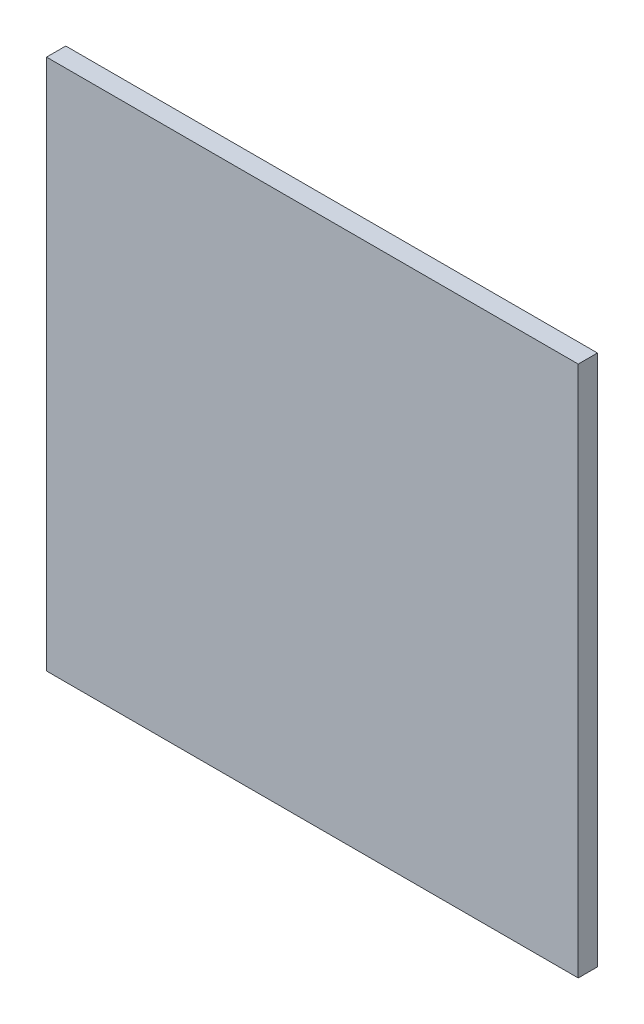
SolidWorks part; units mm, degrees
ref_plane "Alzado" through (0, 0, 0) normal (0, 0, 1) x (1, 0, 0)
ref_plane "Planta" through (0, 0, 0) normal (0, 1, 0) x (1, 0, 0)
ref_plane "Vista lateral" through (0, 0, 0) normal (1, 0, 0) x (0, 0, -1)
sketch "Croquis1" plane through (0, 0, 0) normal (0, 0, 1) x (1, 0, 0)
  line L1 (-207.5, 207.5) -> (207.5, 207.5)
  line L2 (-207.5, 207.5) -> (-207.5, -207.5)
  line L3 (-207.5, -207.5) -> (207.5, -207.5)
  line L4 (207.5, 207.5) -> (207.5, -207.5)
  line L5 (-207.5, 207.5) -> (207.5, -207.5) construction
  line L6 (-207.5, -207.5) -> (207.5, 207.5) construction
  point P0 (0, 0)
  dimension "D1" = 415
  dimension "D2" = 415
extrude "Saliente-Extruir1" add sketch "Croquis1" along normal blind 15
